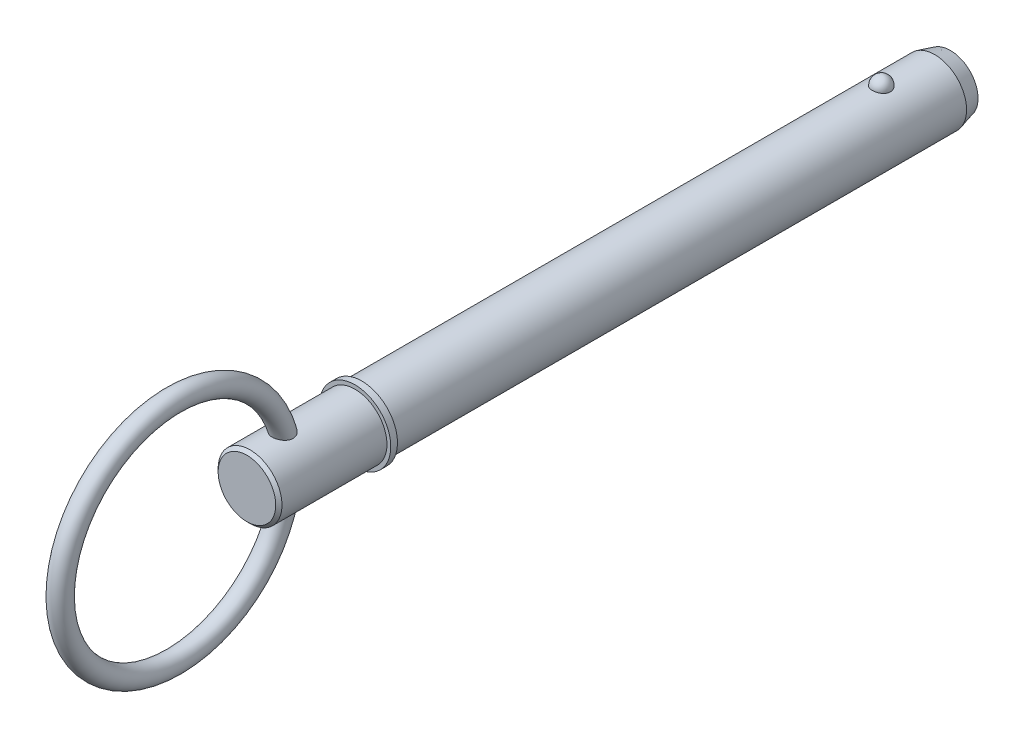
SolidWorks part; units mm, degrees
ref_plane "Front Plane" through (0, 0, 0) normal (0, 0, 1) x (1, 0, 0)
ref_plane "Top Plane" through (0, 0, 0) normal (0, 1, 0) x (1, 0, 0)
ref_plane "Right Plane" through (0, 0, 0) normal (1, 0, 0) x (0, 0, -1)
sketch "Sketch2" plane through (0, 0, 0) normal (0, 0, 1) x (1, 0, 0)
  circle A0 centre (0, 0) radius 7.145
  point P3 (0, 7.145)
  dimension "D1" = 14.29
extrude "Boss-Extrude1" add sketch "Sketch2" along normal blind 114.3
sketch "Sketch3" plane through (0, 0, 0) normal (0, 0, -1) x (-1, 0, 0)
  circle A0 centre (0, 0) radius 7.145
  dimension "D1" = 14.29
extrude "Boss-Extrude2" add sketch "Sketch3" along normal blind 17.45
chamfer "Chamfer1" distance 3.5 angle 15 1 edges at (-7.145, 0, -17.45)
sketch "Sketch18" plane through (0, 0, 0) normal (1, 0, 0) x (0, 0, -1)
  line L0 (13.95, 7.145) -> (-114.3, 7.145) construction
  line L1 (2.02, 9.165) -> (2.02, 5.125)
  line L2 (-114.3, -7.145) -> (13.95, -7.145) construction
  arc A0 (2.02, 9.165) -> (2.02, 5.125) centre (2.02, 7.145) ccw
  point P4 (0, 7.145)
  dimension "D1" = 16.31
revolve "Revolve1" add sketch "Sketch18" angle 360 about L1
sketch "Sketch19" plane through (0, 0, 0) normal (1, 0, 0) x (0, 0, -1)
  line L0 (-33.7288, 0) -> (-46.4542, 0) construction
sketch "Sketch20" plane through (0, 0, 0) normal (1, 0, 0) x (0, 0, -1)
  line L0 (-114.3, 0) -> (-114.3, 8)
  line L1 (-114.3, 7.145) -> (-114.3, -7.145) construction
  line L2 (-114.3, 8) -> (-115.8, 8)
  line L3 (-115.8, 8) -> (-115.8, 0)
  line L4 (-33.7288, 0) -> (-46.4542, 0) construction
  line L5 (-115.8, 0) -> (-114.3, 0)
  dimension "D1" = 8
  dimension "D2" = 1.5
revolve "Revolve2" add sketch "Sketch20" angle 360 about L0
sketch "Sketch21" plane through (0, 0, 114.3) normal (0, 0, -1) x (-1, 0, 0)
  circle A0 centre (0, 0) radius 7.145
  dimension "D1" = 14.29
extrude "Boss-Extrude3" add sketch "Sketch21" against normal blind 25.7
chamfer "Chamfer2" distance 0.7 angle 45 1 edges at (-7.145, 0, 140)
sketch "Sketch23" plane through (0, 0, 0) normal (1, 0, 0) x (0, 0, -1)
  line L0 (-140, 6.445) -> (-140, -6.445) construction
  circle A0 centre (-156.4, 0) radius 25.4
  point P2 (-131, 0)
  dimension "D1" = 50.8
  dimension "D2" = 9
sketch "Sketch24" plane through (0, 0, 0) normal (0, 1, 0) x (1, 0, 0)
  circle A0 centre (0, -131) radius 2.25
  dimension "D1" = 4.5
sweep "Sweep1" add profiles "Sketch24" path "Sketch23"
